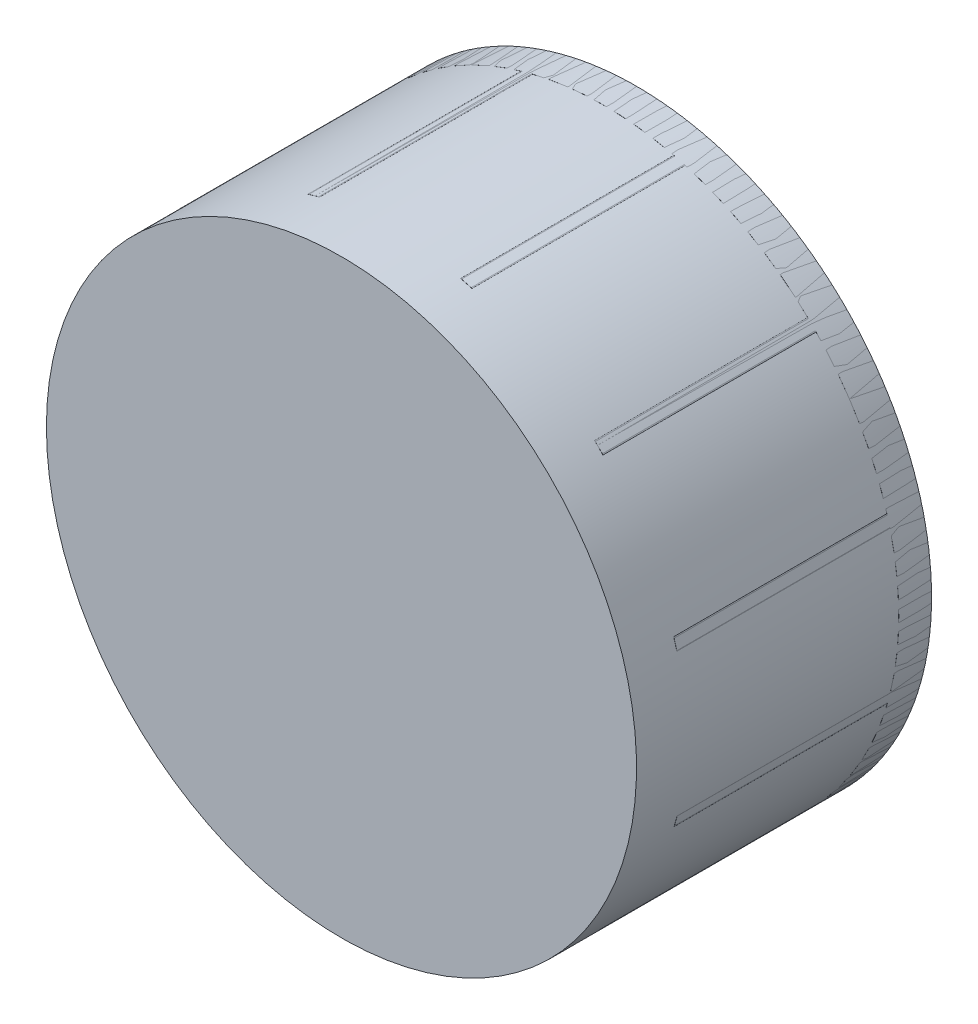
SolidWorks part; units mm, degrees
ref_plane "Front Plane" through (0, 0, 0) normal (0, 0, 1) x (1, 0, 0)
ref_plane "Top Plane" through (0, 0, 0) normal (0, 1, 0) x (1, 0, 0)
ref_plane "Right Plane" through (0, 0, 0) normal (1, 0, 0) x (0, 0, -1)
sketch "Sketch2" plane through (0, 0, 0) normal (0, 0, 1) x (1, 0, 0)
  circle A0 centre (0, 0) radius 18
  circle A1 centre (0, 0) radius 1
  dimension "D1" = 36
  dimension "D2" = 2
extrude "Boss-Extrude1" add sketch "Sketch2" against normal blind 2
sketch "Sketch5" plane through (0, 0, 0) normal (0, 0, 1) x (1, 0, 0)
  circle A0 centre (0, 0) radius 1
  circle A1 centre (0, 0) radius 2
  dimension "D1" = 4
  dimension "D2" = 2
extrude "Boss-Extrude3" add sketch "Sketch5" along normal blind 6
fillet "Fillet6" radius 1 2 edges at (2, 0, 6) (2, 0, 0)
sketch "Sketch6" plane through (0, 0, 0) normal (0, 0, 1) x (1, 0, 0)
  line L0 (0, 0) -> (11.6116, 11.6627) construction
  line L1 (6.0048, 5.3225) -> (13.0494, 12.3981)
  line L2 (5.2961, 6.0281) -> (12.3407, 13.1037)
  line L3 (5.2961, 6.0281) -> (6.0048, 5.3225)
  circle A0 centre (0, 0) radius 8.0241 construction
  circle A2 centre (0, 0) radius 18 construction
  arc A3 (13.0494, 12.3981) -> (12.3407, 13.1037) centre (0, 0) ccw
  dimension "D1" = 0.5
  dimension "D2" = 0.5
extrude "Boss-Extrude4" add sketch "Sketch6" along normal blind 13
fillet "Fillet7" radius 0.2 4 edges at (5.2961, 6.0281, 6.5) (6.0048, 5.3225, 6.5) (13.0494, 12.3981, 6.5) (12.3407, 13.1037, 6.5)
pattern_circular "CirPattern2" count 12 over 360 about axis through (0, 0, 0) along (0, 0, 1) of "Boss-Extrude4", "Fillet7"
sketch "Sketch7" plane through (0, 0, -2) normal (0, 0, -1) x (-1, 0, 0)
  circle A0 centre (0, 0) radius 18
extrude "Boss-Extrude5" add sketch "Sketch7" against normal blind 18 separate body
